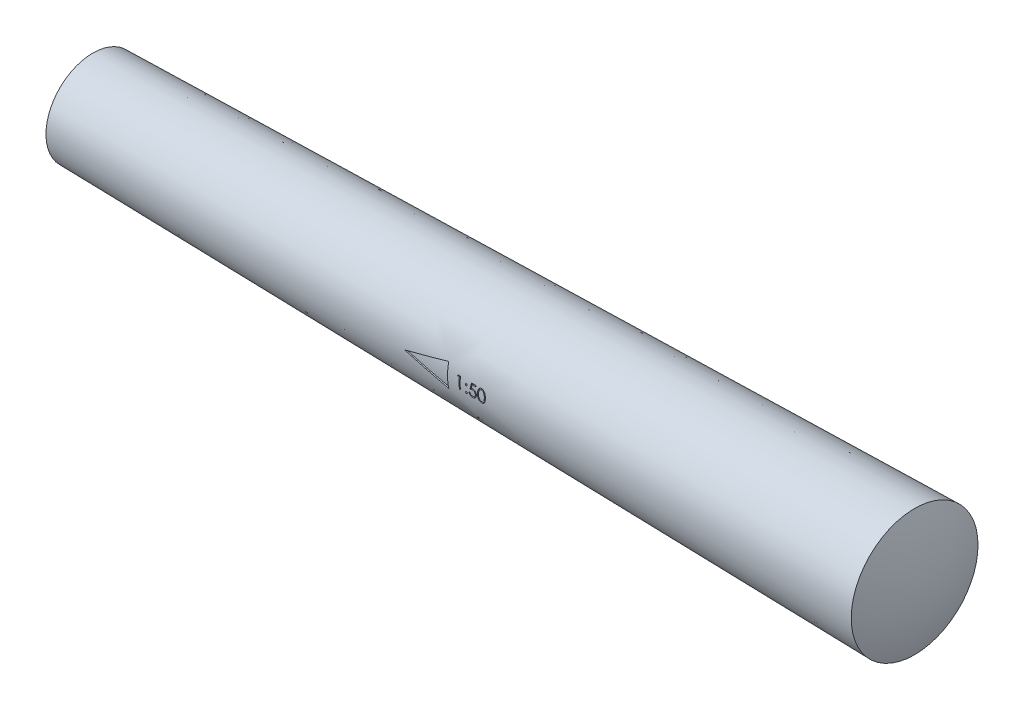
SolidWorks part; units mm, degrees
ref_plane "Front Plane" through (0, 0, 0) normal (0, 0, 1) x (1, 0, 0)
ref_plane "Top Plane" through (0, 0, 0) normal (0, 1, 0) x (1, 0, 0)
ref_plane "Right Plane" through (0, 0, 0) normal (1, 0, 0) x (0, 0, -1)
sketch "Sketch1" plane through (0, 0, 0) normal (1, 0, 0) x (0, 0, -1)
  circle A0 centre (0, 0) radius 4
  dimension "D1" = 8
extrude "Extrude1" add sketch "Sketch1" along normal mid plane 70
draft "Draft1" type of draft neutral plane draft angle 1.146 faces to draft 1 parameters "D1"=1.146
sketch "Sketch2" plane through (0, 0, 0) normal (0, 0, 1) x (1, 0, 0)
  line L0 (-35, 0) -> (-35, 4)
  line L1 (-35, 4) -> (-35, -4) construction
  line L2 (-35, 0) -> (-36, 0)
  line L3 (-36, 0) -> (-36, -4.7) construction
  line L4 (35, 0) -> (35, 5.4)
  line L5 (35, -5.4) -> (35, 5.4) construction
  line L6 (35, 0) -> (36, 0)
  line L7 (36, 0) -> (36, -4.7) construction
  line L8 (-35, -4) -> (35, -5.4) construction
  arc A0 (-36, 0) -> (-35, 4) centre (-27.5, 0) cw
  arc A1 (36, 0) -> (35, 5.4) centre (20.9198, 0) ccw
  point P14 (0, -4.7)
revolve "Revolve1" add sketch "Sketch2" angle 360 about L2
sketch "Sketch5" plane through (0, 0, 0) normal (0, 0, 1) x (1, 0, 0)
  line L0 (0, 4.7) -> (0, -4.7) construction
  line L1 (35, 5.4) -> (-35, 4) construction
  line L2 (-35, -4) -> (35, -5.4) construction
ref_plane "Plane2" through (0, 0, 0) normal (-0.02, 0, 0.9998) x (0.9998, 0, 0.02)
sketch "Sketch6" plane through (0, 0, 0) normal (-0.02, 0, 0.9998) x (0.9998, 0, 0.02)
  line L0 (0, 0) -> (0, 1)
  line L1 (0, 4.7) -> (0, -4.7) construction
  line L2 (0, 1) -> (-3.7321, 0)
  line L3 (-3.7321, 0) -> (0, -1)
  line L4 (0, -1) -> (0, 0)
  line L5 (0, -0.5) -> (4, -0.5) construction
  text T0 "1:50" font "Century Gothic" height 1
  dimension "D1" = 2
  dimension "D2" = 30
  dimension "D3" = 4
wrap "Wrap2" sketch "Sketch6" wrap type deboss source sketch "Sketch6" thickness 0.1 parameters "D1"=0.1
equation "\"D2@Sketch2\" = \"D1@Sketch2\""
